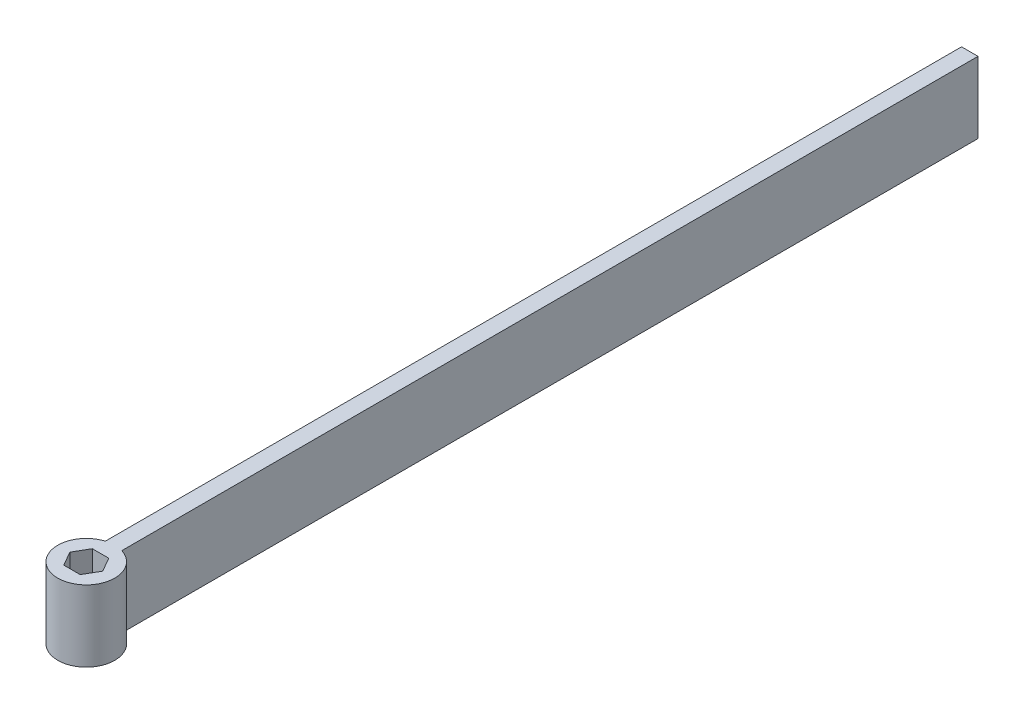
SolidWorks part; units mm, degrees
ref_plane "Front Plane" through (0, 0, 0) normal (0, 0, 1) x (1, 0, 0)
ref_plane "Top Plane" through (0, 0, 0) normal (0, 1, 0) x (1, 0, 0)
ref_plane "Right Plane" through (0, 0, 0) normal (1, 0, 0) x (0, 0, -1)
sketch "Sketch1" plane through (0, 0, 0) normal (0, 1, 0) x (1, 0, 0)
  line L1 (11.547, 0) -> (5.7735, 10)
  line L2 (5.7735, 10) -> (-5.7735, 10)
  line L3 (-5.7735, 10) -> (-11.547, 0)
  line L4 (-11.547, 0) -> (-5.7735, -10)
  line L5 (-5.7735, -10) -> (5.7735, -10)
  line L6 (5.7735, -10) -> (11.547, 0)
  circle A0 centre (0, 0) radius 10 construction
  circle A1 centre (0, 0) radius 20
extrude "Boss-Extrude1" add sketch "Sketch1" along normal blind 50
sketch "Sketch3" plane through (0, 0, -10) normal (0, 0, 1) x (1, 0, 0)
  line L1 (-5.7735, 50) -> (5.7735, 50)
  line L2 (-5.7735, 50) -> (-5.7735, 0)
  line L3 (-5.7735, 0) -> (5.7735, 0)
  line L4 (5.7735, 50) -> (5.7735, 0)
extrude "Boss-Extrude2" add sketch "Sketch3" against normal blind 10
sketch "Sketch4" plane through (0, 0, -20) normal (0, 0, -1) x (-1, 0, 0)
  line L0 (5.7735, 0) -> (-5.7735, 0) construction
  line L1 (0, 0) -> (-2, 0) construction
  line L2 (0, 0) -> (2, 0) construction
  line L3 (-2, 0) -> (-2, 45)
  line L4 (-2, 45) -> (2, 45)
  line L5 (2, 45) -> (2, 0)
  line L6 (2, 0) -> (5.7735, 0)
  line L7 (5.7735, 0) -> (5.7735, 50)
  line L8 (-5.7735, 50) -> (5.7735, 50) construction
  line L9 (5.7735, 50) -> (5.7735, 0) construction
  line L10 (5.7735, 50) -> (-5.7735, 50)
  line L11 (-5.7735, 50) -> (-5.7735, 0)
  line L12 (-5.7735, 0) -> (-2, 0)
extrude "Boss-Extrude3" add sketch "Sketch4" along normal blind 600
